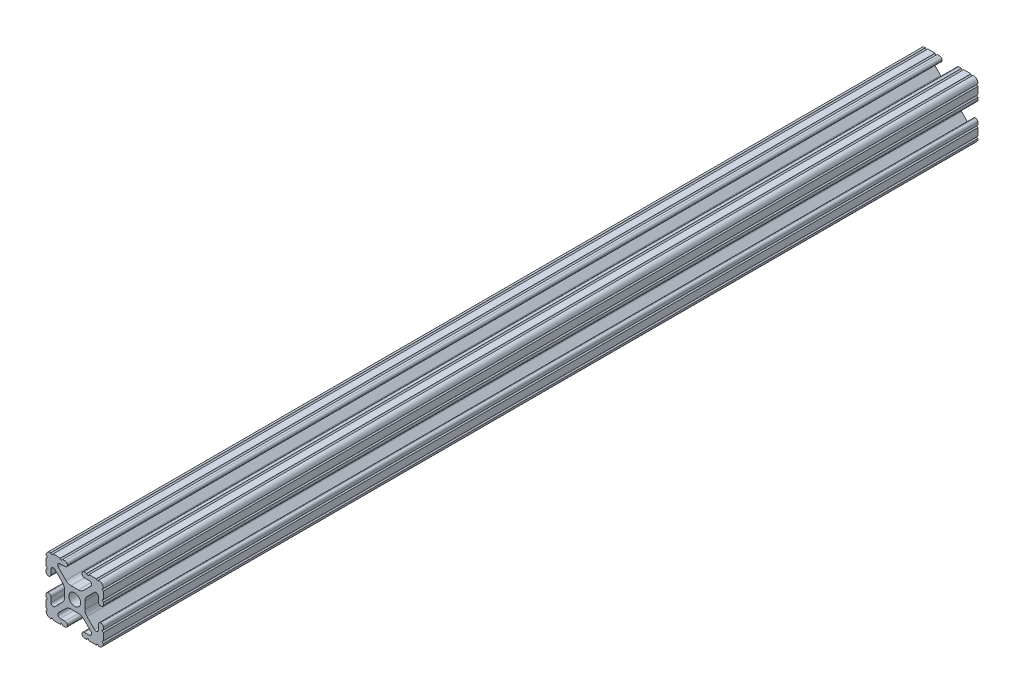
SolidWorks part; units mm, degrees
ref_plane "Front Plane" through (0, 0, 0) normal (0, 0, 1) x (1, 0, 0)
ref_plane "Top Plane" through (0, 0, 0) normal (0, 1, 0) x (1, 0, 0)
ref_plane "Right Plane" through (0, 0, 0) normal (1, 0, 0) x (0, 0, -1)
sketch "Sketch1" plane through (0, 0, 0) normal (0, 0, 1) x (1, 0, 0)
  line L0 (-7.207, 8.7244) -> (-3.8983, 5.4232)
  line L1 (-4.2875, 10.4902) -> (-6.4768, 10.4902)
  line L2 (-3.2385, 11.651) -> (-3.2385, 11.5392)
  line L3 (-5.3171, 12.7) -> (-4.2875, 12.7)
  line L4 (0, 13.4005) -> (0, -14.8534) construction
  line L5 (12.7, 0) -> (-13.9989, 0) construction
  line L6 (-9.5504, 12.7) -> (-6.3331, 12.7)
  line L7 (-12.7, 6.3331) -> (-12.7, 9.5504)
  line L8 (-12.7, 4.2875) -> (-12.7, 5.3171)
  line L9 (-11.5392, 3.2385) -> (-11.651, 3.2385)
  line L10 (-10.4902, 6.4021) -> (-10.4902, 4.2875)
  line L11 (-5.441, 3.8408) -> (-8.7371, 7.1294)
  line L12 (-4.5085, -1.5932) -> (-4.5085, 1.5932)
  line L13 (-1.7093, -4.4958) -> (1.7093, -4.4958)
  line L14 (3.9523, -5.4237) -> (7.1797, -8.6452)
  line L15 (6.4164, -10.4902) -> (4.2875, -10.4902)
  line L16 (3.2385, -11.5392) -> (3.2385, -11.651)
  line L17 (4.2875, -12.7) -> (5.3171, -12.7)
  line L18 (6.3331, -12.7) -> (9.5504, -12.7)
  line L19 (12.7, -9.5504) -> (12.7, -6.3331)
  line L20 (12.7, -5.3171) -> (12.7, -4.2875)
  line L21 (11.651, -3.2385) -> (11.5392, -3.2385)
  line L22 (10.4902, -4.2875) -> (10.4902, -6.4021)
  line L23 (8.7371, -7.1294) -> (5.441, -3.8408)
  line L24 (4.5085, -1.5932) -> (4.5085, 1.5932)
  line L25 (5.441, 3.8408) -> (8.7371, 7.1294)
  line L26 (10.4902, 6.4021) -> (10.4902, 4.2875)
  line L27 (11.5392, 3.2385) -> (11.651, 3.2385)
  line L28 (12.7, 4.2875) -> (12.7, 5.3171)
  line L29 (12.7, 6.3331) -> (12.7, 9.5504)
  line L30 (9.5504, 12.7) -> (6.3331, 12.7)
  line L31 (5.3171, 12.7) -> (4.2875, 12.7)
  line L32 (3.2385, 11.651) -> (3.2385, 11.5392)
  line L33 (4.2875, 10.4902) -> (6.4768, 10.4902)
  line L34 (7.207, 8.7244) -> (3.8983, 5.4232)
  line L35 (1.6558, 4.4958) -> (-1.6558, 4.4958)
  line L36 (-8.7371, -7.1294) -> (-5.441, -3.8408)
  line L37 (-10.4902, -4.2875) -> (-10.4902, -6.4021)
  line L38 (-11.651, -3.2385) -> (-11.5392, -3.2385)
  line L39 (-12.7, -5.3171) -> (-12.7, -4.2875)
  line L40 (-12.7, -9.5504) -> (-12.7, -6.3331)
  line L41 (-6.3331, -12.7) -> (-9.5504, -12.7)
  line L42 (-4.2875, -12.7) -> (-5.3171, -12.7)
  line L43 (-3.2385, -11.5392) -> (-3.2385, -11.651)
  line L44 (-6.4164, -10.4902) -> (-4.2875, -10.4902)
  line L45 (-3.9523, -5.4237) -> (-7.1797, -8.6452)
  arc A0 (-7.207, 8.7244) -> (-6.4768, 10.4902) centre (-6.4768, 9.4563) cw
  arc A1 (-3.2385, 11.5392) -> (-4.2875, 10.4902) centre (-4.2875, 11.5392) cw
  arc A2 (-4.2875, 12.7) -> (-3.2385, 11.651) centre (-4.2875, 11.651) cw
  arc A3 (-5.3171, 12.7) -> (-6.3331, 12.7) centre (-5.8251, 12.7) cw
  arc A4 (-9.5504, 12.7) -> (-10.5664, 12.6998) centre (-10.0584, 12.7) cw
  arc A5 (-12.6998, 10.5664) -> (-10.5664, 12.6998) centre (-10.5918, 10.5918) cw
  arc A6 (-12.6998, 10.5664) -> (-12.7, 9.5504) centre (-12.7, 10.0584) cw
  arc A7 (-12.7, 6.3331) -> (-12.7, 5.3171) centre (-12.7, 5.8251) cw
  arc A8 (-11.651, 3.2385) -> (-12.7, 4.2875) centre (-11.651, 4.2875) cw
  arc A9 (-10.4902, 4.2875) -> (-11.5392, 3.2385) centre (-11.5392, 4.2875) cw
  circle A10 centre (0, 0) radius 2.6035
  arc A11 (-10.4902, 6.4021) -> (-8.7371, 7.1294) centre (-9.4628, 6.4021) cw
  arc A12 (-5.441, 3.8408) -> (-4.5085, 1.5932) centre (-7.6835, 1.5932) cw
  arc A13 (-4.5085, -1.5932) -> (-5.441, -3.8408) centre (-7.6835, -1.5932) cw
  arc A14 (-8.7371, -7.1294) -> (-10.4902, -6.4021) centre (-9.4628, -6.4021) cw
  arc A15 (-1.7093, -4.4958) -> (-3.9523, -5.4237) centre (-1.7093, -7.6708) ccw
  arc A16 (3.9523, -5.4237) -> (1.7093, -4.4958) centre (1.7093, -7.6708) ccw
  arc A17 (6.4164, -10.4902) -> (7.1797, -8.6452) centre (6.4164, -9.4098) ccw
  arc A18 (4.2875, -10.4902) -> (3.2385, -11.5392) centre (4.2875, -11.5392) ccw
  arc A19 (3.2385, -11.651) -> (4.2875, -12.7) centre (4.2875, -11.651) ccw
  arc A20 (6.3331, -12.7) -> (5.3171, -12.7) centre (5.8251, -12.7) ccw
  arc A21 (10.5664, -12.6998) -> (9.5504, -12.7) centre (10.0584, -12.7) ccw
  arc A22 (10.5664, -12.6998) -> (12.6998, -10.5664) centre (10.5918, -10.5918) ccw
  arc A23 (12.7, -9.5504) -> (12.6998, -10.5664) centre (12.7, -10.0584) ccw
  arc A24 (12.7, -5.3171) -> (12.7, -6.3331) centre (12.7, -5.8251) ccw
  arc A25 (12.7, -4.2875) -> (11.651, -3.2385) centre (11.651, -4.2875) ccw
  arc A26 (11.5392, -3.2385) -> (10.4902, -4.2875) centre (11.5392, -4.2875) ccw
  arc A27 (8.7371, -7.1294) -> (10.4902, -6.4021) centre (9.4628, -6.4021) ccw
  arc A28 (4.5085, -1.5932) -> (5.441, -3.8408) centre (7.6835, -1.5932) ccw
  arc A29 (5.441, 3.8408) -> (4.5085, 1.5932) centre (7.6835, 1.5932) ccw
  arc A30 (10.4902, 6.4021) -> (8.7371, 7.1294) centre (9.4628, 6.4021) ccw
  arc A31 (10.4902, 4.2875) -> (11.5392, 3.2385) centre (11.5392, 4.2875) ccw
  arc A32 (11.651, 3.2385) -> (12.7, 4.2875) centre (11.651, 4.2875) ccw
  arc A33 (12.7, 6.3331) -> (12.7, 5.3171) centre (12.7, 5.8251) ccw
  arc A34 (12.6998, 10.5664) -> (12.7, 9.5504) centre (12.7, 10.0584) ccw
  arc A35 (12.6998, 10.5664) -> (10.5664, 12.6998) centre (10.5918, 10.5918) ccw
  arc A36 (9.5504, 12.7) -> (10.5664, 12.6998) centre (10.0584, 12.7) ccw
  arc A37 (5.3171, 12.7) -> (6.3331, 12.7) centre (5.8251, 12.7) ccw
  arc A38 (4.2875, 12.7) -> (3.2385, 11.651) centre (4.2875, 11.651) ccw
  arc A39 (3.2385, 11.5392) -> (4.2875, 10.4902) centre (4.2875, 11.5392) ccw
  arc A40 (7.207, 8.7244) -> (6.4768, 10.4902) centre (6.4768, 9.4563) ccw
  arc A41 (1.6558, 4.4958) -> (3.8983, 5.4232) centre (1.6558, 7.6708) ccw
  arc A42 (-1.6558, 4.4958) -> (-3.8983, 5.4232) centre (-1.6558, 7.6708) cw
  arc A43 (-11.5392, -3.2385) -> (-10.4902, -4.2875) centre (-11.5392, -4.2875) cw
  arc A44 (-12.7, -4.2875) -> (-11.651, -3.2385) centre (-11.651, -4.2875) cw
  arc A45 (-12.7, -5.3171) -> (-12.7, -6.3331) centre (-12.7, -5.8251) cw
  arc A46 (-12.7, -9.5504) -> (-12.6998, -10.5664) centre (-12.7, -10.0584) cw
  arc A47 (-10.5664, -12.6998) -> (-12.6998, -10.5664) centre (-10.5918, -10.5918) cw
  arc A48 (-10.5664, -12.6998) -> (-9.5504, -12.7) centre (-10.0584, -12.7) cw
  arc A49 (-6.3331, -12.7) -> (-5.3171, -12.7) centre (-5.8251, -12.7) cw
  arc A50 (-3.2385, -11.651) -> (-4.2875, -12.7) centre (-4.2875, -11.651) cw
  arc A51 (-4.2875, -10.4902) -> (-3.2385, -11.5392) centre (-4.2875, -11.5392) cw
  arc A52 (-6.4164, -10.4902) -> (-7.1797, -8.6452) centre (-6.4164, -9.4098) cw
  dimension "D1" = 5.207
  dimension "D9" = 14.859
  dimension "D2" = 25.4
  dimension "D3" = 12.7
  dimension "D4" = 6.477
  dimension "D5" = 8.2042
  dimension "D6" = 9.017
  dimension "D8" = 2.2098
  dimension "D10" = 2.2098
extrude "Extrude1" add sketch "Sketch1" against normal blind 387.35
